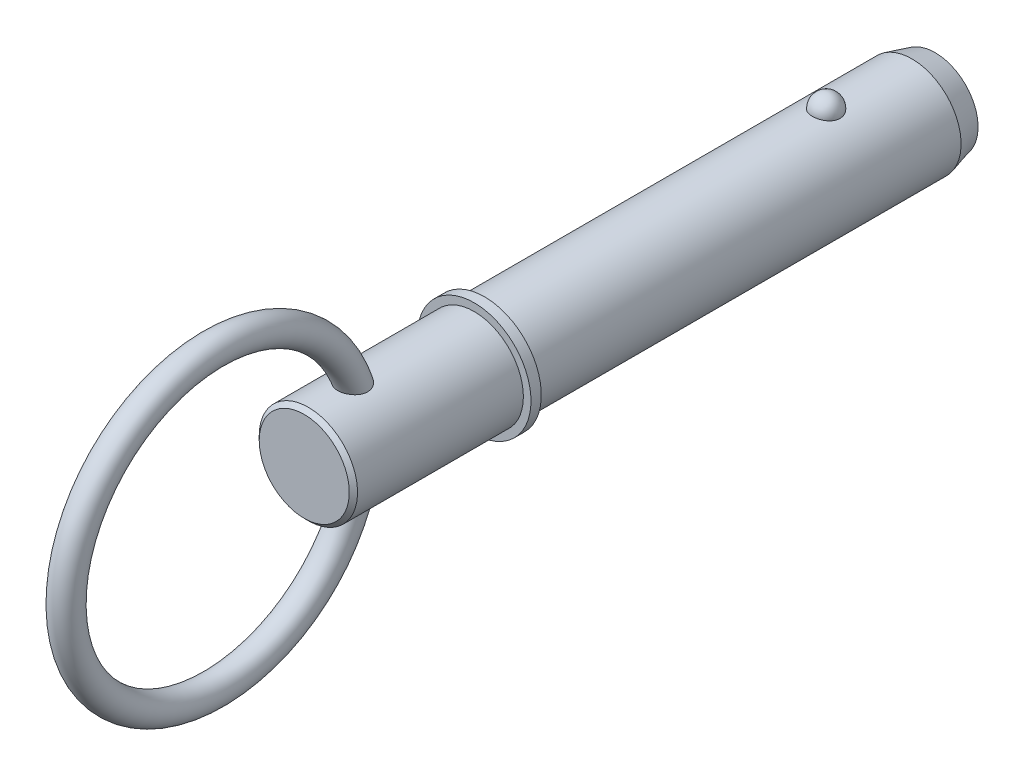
SolidWorks part; units mm, degrees
ref_plane "Front Plane" through (0, 0, 0) normal (0, 0, 1) x (1, 0, 0)
ref_plane "Top Plane" through (0, 0, 0) normal (0, 1, 0) x (1, 0, 0)
ref_plane "Right Plane" through (0, 0, 0) normal (1, 0, 0) x (0, 0, -1)
sketch "Sketch2" plane through (0, 0, 0) normal (0, 0, 1) x (1, 0, 0)
  circle A0 centre (0, 0) radius 9.525
  point P3 (0, 9.525)
  dimension "D1" = 19.05
extrude "Boss-Extrude1" add sketch "Sketch2" along normal blind 63.5
sketch "Sketch3" plane through (0, 0, 0) normal (0, 0, -1) x (-1, 0, 0)
  circle A0 centre (0, 0) radius 9.525
  dimension "D1" = 19.05
extrude "Boss-Extrude2" add sketch "Sketch3" along normal blind 23.8
chamfer "Chamfer1" distance 4.5 angle 15 1 edges at (-9.525, 0, -23.8)
sketch "Sketch18" plane through (0, 0, 0) normal (1, 0, 0) x (0, 0, -1)
  line L0 (19.3, 9.525) -> (-63.5, 9.525) construction
  line L1 (2.69, 12.215) -> (2.69, 6.835)
  line L2 (-63.5, -9.525) -> (19.3, -9.525) construction
  arc A0 (2.69, 12.215) -> (2.69, 6.835) centre (2.69, 9.525) ccw
  point P4 (0, 9.525)
  dimension "D1" = 21.74
revolve "Revolve1" add sketch "Sketch18" angle 360 about L1
sketch "Sketch19" plane through (0, 0, 0) normal (1, 0, 0) x (0, 0, -1)
  line L0 (-33.7288, 0) -> (-46.4542, 0) construction
sketch "Sketch20" plane through (0, 0, 0) normal (1, 0, 0) x (0, 0, -1)
  line L0 (-63.5, 0) -> (-63.5, 11)
  line L1 (-63.5, 9.525) -> (-63.5, -9.525) construction
  line L2 (-63.5, 11) -> (-65.5, 11)
  line L3 (-65.5, 11) -> (-65.5, 0)
  line L4 (-33.7288, 0) -> (-46.4542, 0) construction
  line L5 (-65.5, 0) -> (-63.5, 0)
  dimension "D1" = 11
  dimension "D2" = 2
revolve "Revolve2" add sketch "Sketch20" angle 360 about L0
sketch "Sketch21" plane through (0, 0, 63.5) normal (0, 0, -1) x (-1, 0, 0)
  circle A0 centre (0, 0) radius 9.525
  dimension "D1" = 19.05
extrude "Boss-Extrude3" add sketch "Sketch21" against normal blind 34.93
chamfer "Chamfer2" distance 0.8 angle 45 1 edges at (-9.525, 0, 98.43)
sketch "Sketch23" plane through (0, 0, 0) normal (1, 0, 0) x (0, 0, -1)
  line L0 (-98.43, 8.725) -> (-98.43, -8.725) construction
  circle A0 centre (-116.005, 0) radius 28.575
  point P2 (-87.43, 0)
  dimension "D1" = 57.15
  dimension "D2" = 11
sketch "Sketch24" plane through (0, 0, 0) normal (0, 1, 0) x (1, 0, 0)
  circle A0 centre (0, -87.43) radius 2.75
  dimension "D1" = 5.5
sweep "Sweep1" add profiles "Sketch24" path "Sketch23"
